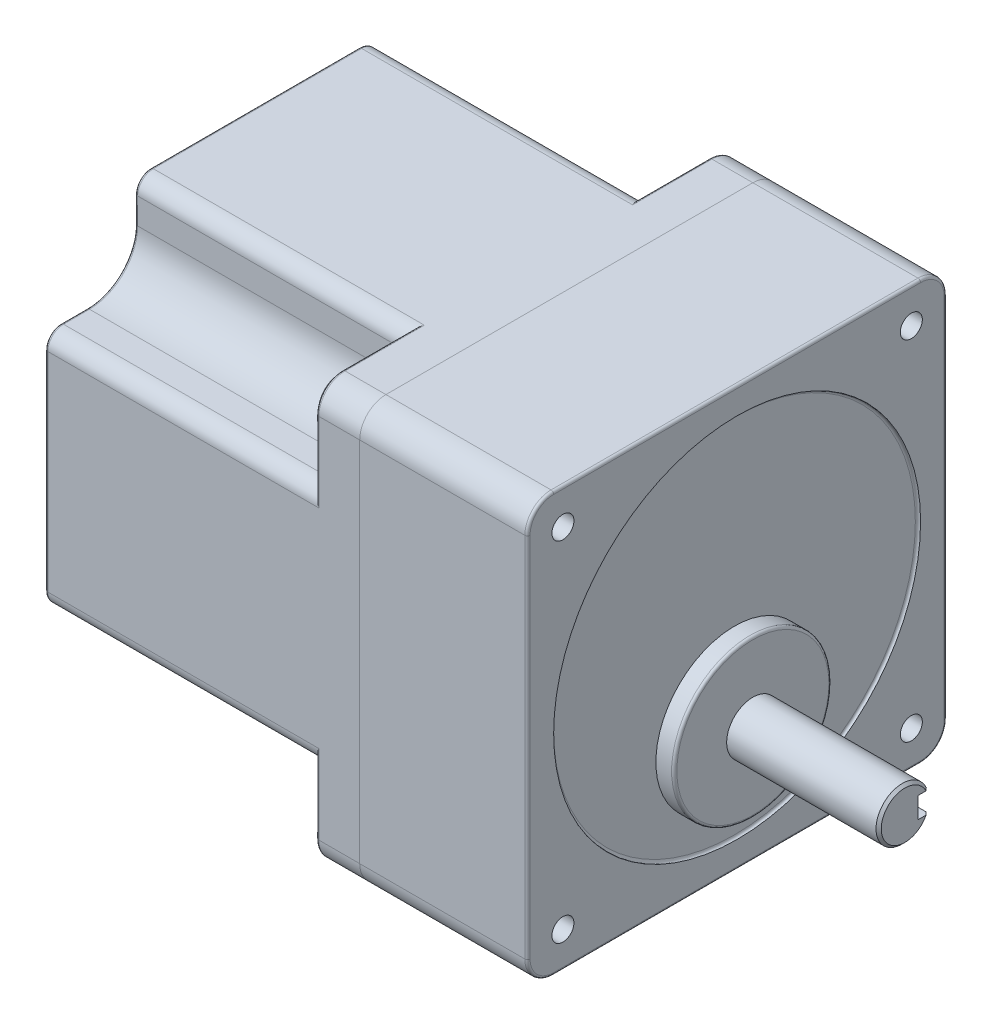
SolidWorks part; units mm, degrees
ref_plane "前视基准面" through (0, 0, 0) normal (0, 0, 1) x (1, 0, 0)
ref_plane "上视基准面" through (0, 0, 0) normal (0, 1, 0) x (1, 0, 0)
ref_plane "右视基准面" through (0, 0, 0) normal (1, 0, 0) x (0, 0, -1)
sketch "草图1" plane through (0, 0, 0) normal (1, 0, 0) x (0, 0, -1)
  line L1 (-35, -40) -> (35, -40)
  line L2 (-40, -35) -> (-40, 35)
  line L3 (-35, 40) -> (35, 40)
  line L4 (40, -35) -> (40, 35)
  line L5 (-40, -40) -> (40, 40) construction
  line L6 (-40, 40) -> (40, -40) construction
  arc A0 (35, 40) -> (40, 35) centre (35, 35) cw
  arc A1 (35, -40) -> (40, -35) centre (35, -35) ccw
  arc A2 (-35, -40) -> (-40, -35) centre (-35, -35) cw
  arc A3 (-40, 35) -> (-35, 40) centre (-35, 35) cw
  point P0 (0, 0)
  dimension "D1" = 5
extrude "凸台-拉伸1" add sketch "草图1" against normal blind 32
sketch "草图2" plane through (-32, 0, 0) normal (-1, 0, 0) x (0, 0, 1)
  line L0 (-35, 40) -> (35, 40) construction
  line L1 (-35, -40) -> (35, -40)
  line L2 (-40, -35) -> (-40, 35)
  line L3 (-35, 40) -> (35, 40)
  line L4 (40, -35) -> (40, 35)
  line L5 (-40, -40) -> (40, 40) construction
  line L6 (-40, 40) -> (40, -40) construction
  arc A0 (35, 40) -> (40, 35) centre (35, 35) cw
  arc A1 (35, -40) -> (40, -35) centre (35, -35) ccw
  arc A2 (-35, -40) -> (-40, -35) centre (-35, -35) cw
  arc A3 (-40, 35) -> (-35, 40) centre (-35, 35) cw
  point P0 (0, 0)
  dimension "D1" = 5
extrude "凸台-拉伸2" add sketch "草图2" along normal blind 60 separate body
sketch "草图3" plane through (-92, 0, 0) normal (-1, 0, 0) x (0, 0, 1)
  line L0 (-32.0461, 22.8686) -> (-37, 22.8686)
  line L1 (-40, 35) -> (-40, -35) construction
  line L3 (-32.0461, -22.8686) -> (-37, -22.8686)
  line L5 (-22.8686, -32.0461) -> (-22.8686, -37)
  line L6 (-35, -40) -> (35, -40) construction
  line L8 (22.8686, -32.0461) -> (22.8686, -37)
  line L10 (32.0461, -22.8686) -> (37, -22.8686)
  line L11 (40, -35) -> (40, 35) construction
  line L12 (-40, 19.8686) -> (-40, 35)
  line L13 (32.0461, 22.8686) -> (37, 22.8686)
  line L14 (-35, 40) -> (-19.8686, 40)
  line L15 (22.8686, 32.0461) -> (22.8686, 37)
  line L16 (35, 40) -> (-35, 40) construction
  line L17 (19.8686, 40) -> (35, 40)
  line L18 (-22.8686, 32.0461) -> (-22.8686, 37)
  line L19 (40, 35) -> (40, 19.8686)
  line L20 (40, -19.8686) -> (40, -35)
  line L21 (35, -40) -> (19.8686, -40)
  line L22 (-19.8686, -40) -> (-35, -40)
  line L23 (-40, -35) -> (-40, -19.8686)
  arc A0 (22.8686, 37) -> (19.8686, 40) centre (19.8686, 37) ccw
  arc A1 (37, 22.8686) -> (40, 19.8686) centre (37, 19.8686) cw
  arc A2 (37, -22.8686) -> (40, -19.8686) centre (37, -19.8686) ccw
  arc A3 (22.8686, -37) -> (19.8686, -40) centre (19.8686, -37) cw
  arc A4 (-22.8686, -32.0461) -> (-32.0461, -22.8686) centre (-32.0461, -32.0461) ccw
  arc A5 (32.0461, -22.8686) -> (22.8686, -32.0461) centre (32.0461, -32.0461) ccw
  arc A6 (22.8686, 32.0461) -> (32.0461, 22.8686) centre (32.0461, 32.0461) ccw
  arc A7 (-32.0461, 22.8686) -> (-22.8686, 32.0461) centre (-32.0461, 32.0461) ccw
  arc A8 (-40, -35) -> (-35, -40) centre (-35, -35) ccw
  arc A9 (-35, 40) -> (-40, 35) centre (-35, 35) ccw
  arc A10 (40, 35) -> (35, 40) centre (35, 35) ccw
  arc A11 (35, -40) -> (40, -35) centre (35, -35) ccw
  arc A12 (-22.8686, -37) -> (-19.8686, -40) centre (-19.8686, -37) ccw
  arc A13 (-37, -22.8686) -> (-40, -19.8686) centre (-37, -19.8686) cw
  arc A14 (-37, 22.8686) -> (-40, 19.8686) centre (-37, 19.8686) ccw
  arc A15 (-22.8686, 37) -> (-19.8686, 40) centre (-19.8686, 37) cw
  point P2 (0, 0)
  point P35 (22.8686, 40)
  point P54 (40, 22.8686)
  point P57 (40, -22.8686)
  point P60 (22.8686, -40)
  point P63 (-22.8686, -40)
  point P66 (-40, -22.8686)
  point P69 (-40, 22.8686)
  point P72 (-22.8686, 40)
  dimension "D1" = 3
extrude "切除-拉伸2" cut sketch "草图3" against normal blind 51.7
sketch "草图4" plane through (0, 0, 0) normal (1, 0, 0) x (0, 0, -1)
  circle A0 centre (0, 0) radius 35
extrude "切除-拉伸3" cut sketch "草图4" against normal blind 0.5
fillet "圆角1" radius 0.5 1 edges at (-0.5, 0, -35)
sketch "草图5" plane through (-0.5, 0, 0) normal (1, 0, 0) x (0, 0, -1)
  circle A0 centre (0, -15) radius 15
extrude "凸台-拉伸3" add sketch "草图5" along normal blind 3.5
fillet "圆角2" radius 0.5 1 edges at (3, -15, -15)
fillet "圆角3" radius 0.5 8 edges at (0, -38.5355, 38.5355) (0, -40, 0) (0, -38.5355, -38.5355) (0, 38.5355, -38.5355) (0, 40, 0) (0, 38.5355, 38.5355) (0, 0, 40) (0, 0, -40)
fillet "圆角4" radius 0.5 24 edges at (-92, 25.5566, 25.5566) (-92, 22.8686, 34.523) (-92, 21.9899, 39.1213) (-92, 0, 40) (-92, -21.9899, 39.1213) (-92, -22.8686, 34.523) (-92, -25.5566, 25.5566) (-92, -34.523, 22.8686) (-92, -39.1213, 21.9899) (-92, -40, 0) (-92, -39.1213, -21.9899) (-92, -34.523, -22.8686) (-92, -25.5566, -25.5566) (-92, -22.8686, -34.523) (-92, -21.9899, -39.1213) (-92, 0, -40) (-92, 21.9899, -39.1213) (-92, 22.8686, -34.523) (-92, 25.5566, -25.5566) (-92, 34.523, -22.8686) (-92, 39.1213, -21.9899) (-92, 40, 0) (-92, 39.1213, 21.9899) (-92, 34.523, 22.8686)
sketch "草图6" plane through (3, 0, 0) normal (1, 0, 0) x (0, 0, -1)
  circle A0 centre (0, -15) radius 5
extrude "凸台-拉伸4" add sketch "草图6" along normal blind 29
ref_plane "基准面1" through (0, 0, -5) normal (0, 0, 1) x (1, 0, 0)
sketch "草图7" plane through (0, 0, -5) normal (0, 0, 1) x (1, 0, 0)
  line L1 (32, -20) -> (32, -10) construction
  line L2 (32, -13) -> (9, -13)
  line L3 (32, -13) -> (32, -17)
  line L4 (32, -17) -> (9, -17)
  arc A0 (9, -13) -> (9, -17) centre (9, -15) ccw
extrude "切除-拉伸5" cut sketch "草图7" along normal blind 2.5
chamfer "倒角1" distance 0.5 angle 45 1 edges at (32, -15, 5)
sketch "草图9" plane through (0, 0, 0) normal (1, 0, 0) x (0, 0, -1)
  point P19 (-33.234, 33.234)
  point P20 (33.234, 33.234)
  point P21 (33.234, -33.234)
  point P22 (-33.234, -33.234)
hole_wizard "M5 螺纹孔1" positions "3D草图1" profile "草图10" tap size "M5" standard "GB"
sketch3d "3D草图1"
  point P0 (0, 33.234, 33.234)
  point P3 (0, 33.234, -33.234)
  point P6 (0, -33.234, -33.234)
  point P9 (0, -33.234, 33.234)
sketch "草图10" plane through (0, 33.234, 33.234) normal (0, 1, 0) x (0, 0, -1)
  line L0 (0, 0) -> (0, 15.2618)
  line L1 (0, 15.2618) -> (2.1, 14)
  line L2 (2.1, 14) -> (2.1, 0)
  line L5 (2.1, 0) -> (0, 0)
  line L10 (0, 15.2618) -> (-2.1, 14) construction
  line L11 (0, -6.35) -> (0, 107.95) construction
  dimension "螺纹孔钻头直径" = 4.2
  dimension "螺纹孔钻头深度" = 14
  dimension "导头角度" = 118
sketch "草图11" plane through (-40.3, 0, 0) normal (-1, 0, 0) x (0, 0, 1)
  circle A0 centre (-32.0461, 32.0461) radius 4
  circle A1 centre (32.0461, 32.0461) radius 4
  circle A2 centre (32.0461, -32.0461) radius 4
  circle A3 centre (-32.0461, -32.0461) radius 4
extrude "凸台-拉伸5" add sketch "草图11" along normal blind 3.5 separate body
sketch "草图12" plane through (-43.8, 0, 0) normal (-1, 0, 0) x (0, 0, 1)
  line L1 (-30.7774, 34.2778) -> (-33.3444, 34.2607)
  line L2 (-33.3444, 34.2607) -> (-34.6132, 32.029)
  line L3 (-34.6132, 32.029) -> (-33.3148, 29.8144)
  line L4 (-33.3148, 29.8144) -> (-30.7477, 29.8315)
  line L5 (-30.7477, 29.8315) -> (-29.479, 32.0632)
  line L6 (-29.479, 32.0632) -> (-30.7774, 34.2778)
  line L7 (33.2714, 34.2778) -> (30.726, 34.2231)
  line L8 (30.726, 34.2231) -> (29.5007, 31.9914)
  line L9 (29.5007, 31.9914) -> (30.8208, 29.8144)
  line L10 (30.8208, 29.8144) -> (33.3661, 29.8691)
  line L11 (33.3661, 29.8691) -> (34.5915, 32.1008)
  line L12 (34.5915, 32.1008) -> (33.2714, 34.2778)
  line L13 (-30.7477, -29.7159) -> (-33.4149, -29.7566)
  line L14 (-33.4149, -29.7566) -> (-34.7132, -32.0868)
  line L15 (-34.7132, -32.0868) -> (-33.3444, -34.3762)
  line L16 (-33.3444, -34.3762) -> (-30.6773, -34.3356)
  line L17 (-30.6773, -34.3356) -> (-29.379, -32.0054)
  line L18 (-29.379, -32.0054) -> (-30.7477, -29.7159)
  line L19 (30.6027, -34.5461) -> (33.4895, -34.5461)
  line L20 (33.4895, -34.5461) -> (34.9328, -32.0461)
  line L21 (34.9328, -32.0461) -> (33.4895, -29.5461)
  line L22 (33.4895, -29.5461) -> (30.6027, -29.5461)
  line L23 (30.6027, -29.5461) -> (29.1593, -32.0461)
  line L24 (29.1593, -32.0461) -> (30.6027, -34.5461)
  circle A0 centre (-32.0461, 32.0461) radius 2.2232 construction
  circle A1 centre (32.0461, 32.0461) radius 2.2049 construction
  circle A2 centre (-32.0461, -32.0461) radius 2.3101 construction
  circle A3 centre (32.0461, -32.0461) radius 2.5 construction
extrude "切除-拉伸6" cut sketch "草图12" against normal blind 1.5
chamfer "倒角2" distance 0.3 angle 45 6 edges at (-43.8, 30.9217, -33.964) (-43.8, 29.8229, -32.0313) (-43.8, 30.9473, -30.1134) (-43.8, 33.1705, -30.1282) (-43.8, 33.1448, -33.9788) (-43.8, 34.2692, -32.0609)
chamfer "倒角3" distance 0.3 angle 45 6 edges at (-43.8, 33.1893, 33.9314) (-43.8, 30.9849, 33.9788) (-43.8, 29.8417, 32.0934) (-43.8, 30.9029, 30.1607) (-43.8, 33.1072, 30.1134) (-43.8, 34.2504, 31.9987)
chamfer "倒角4" distance 0.3 angle 45 6 edges at (-43.8, -30.7961, 34.2112) (-43.8, -33.2961, 34.2112) (-43.8, -34.5461, 32.0461) (-43.8, -33.2961, 29.881) (-43.8, -30.7961, 29.881) (-43.8, -29.5461, 32.0461)
chamfer "倒角5" distance 0.3 angle 45 6 edges at (-43.8, -30.8607, -30.0633) (-43.8, -33.1705, -30.0281) (-43.8, -34.3559, -32.0109) (-43.8, -33.2315, -34.0288) (-43.8, -30.9217, -34.064) (-43.8, -29.7363, -32.0813)
fillet "圆角6" radius 0.5 12 edges at (-40.3, 40, -27.4343) (-40.3, 38.5355, -38.5355) (-40.3, 27.4343, -40) (-40.3, -27.4343, -40) (-40.3, -38.5355, -38.5355) (-40.3, -40, -27.4343) (-40.3, -40, 27.4343) (-40.3, -38.5355, 38.5355) (-40.3, -27.4343, 40) (-40.3, 40, 27.4343) (-40.3, 38.5355, 38.5355) (-40.3, 27.4343, 40)
